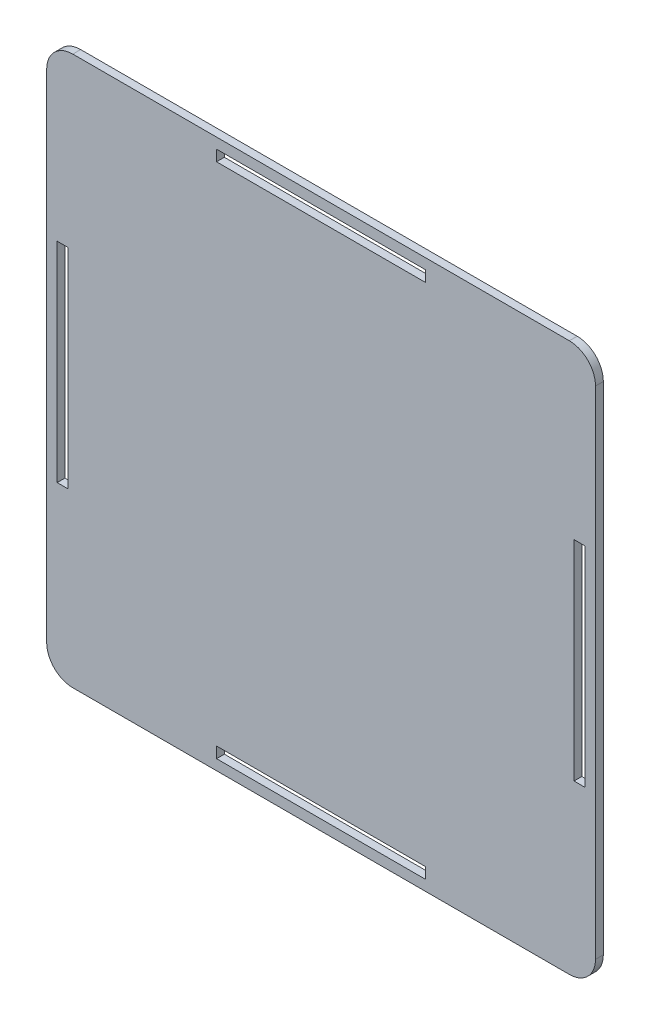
SolidWorks part; units mm, degrees
ref_plane "Plan de face" through (0, 0, 0) normal (0, 0, 1) x (1, 0, 0)
ref_plane "Plan de dessus" through (0, 0, 0) normal (0, 1, 0) x (1, 0, 0)
ref_plane "Plan de droite" through (0, 0, 0) normal (1, 0, 0) x (0, 0, -1)
sketch "Esquisse1" plane through (0, 0, 0) normal (0, 0, 1) x (1, 0, 0)
  line L0 (-52.5, 52.5) -> (52.5, -52.5) construction
  line L5 (-47.5, 52.5) -> (47.5, 52.5)
  line L14 (-52.5, 47.5) -> (-52.5, -47.5)
  line L15 (-47.5, -52.5) -> (47.5, -52.5)
  line L24 (52.5, 47.5) -> (52.5, -47.5)
  line L25 (0, 0) -> (-76.9343, 0) construction
  line L26 (-50.5, 20) -> (-48.4, 20)
  line L27 (-50.5, 20) -> (-50.5, -20)
  line L28 (-50.5, -20) -> (-48.4, -20)
  line L29 (-48.4, 20) -> (-48.4, -20)
  line L30 (20, 50.5) -> (20, 48.4)
  line L31 (20, 50.5) -> (-20, 50.5)
  line L32 (-20, 50.5) -> (-20, 48.4)
  line L33 (20, 48.4) -> (-20, 48.4)
  line L34 (50.5, -20) -> (48.4, -20)
  line L35 (50.5, -20) -> (50.5, 20)
  line L36 (50.5, 20) -> (48.4, 20)
  line L37 (48.4, -20) -> (48.4, 20)
  line L38 (-20, -50.5) -> (-20, -48.4)
  line L39 (-20, -50.5) -> (20, -50.5)
  line L40 (20, -50.5) -> (20, -48.4)
  line L41 (-20, -48.4) -> (20, -48.4)
  arc A0 (-52.5, -47.5) -> (-47.5, -52.5) centre (-47.5, -47.5) ccw
  arc A1 (47.5, -52.5) -> (52.5, -47.5) centre (47.5, -47.5) ccw
  arc A2 (47.5, 52.5) -> (52.5, 47.5) centre (47.5, 47.5) cw
  arc A3 (-47.5, 52.5) -> (-52.5, 47.5) centre (-47.5, 47.5) ccw
  point P30 (52.5, 52.5)
  dimension "D6" = 5
  dimension "D1" = 105
  dimension "D2" = 2.1
  dimension "D3" = 40
  dimension "D4" = 2
  dimension "D5" = 4
extrude "Boss.-Extru.1" add sketch "Esquisse1" along normal blind 1.5
